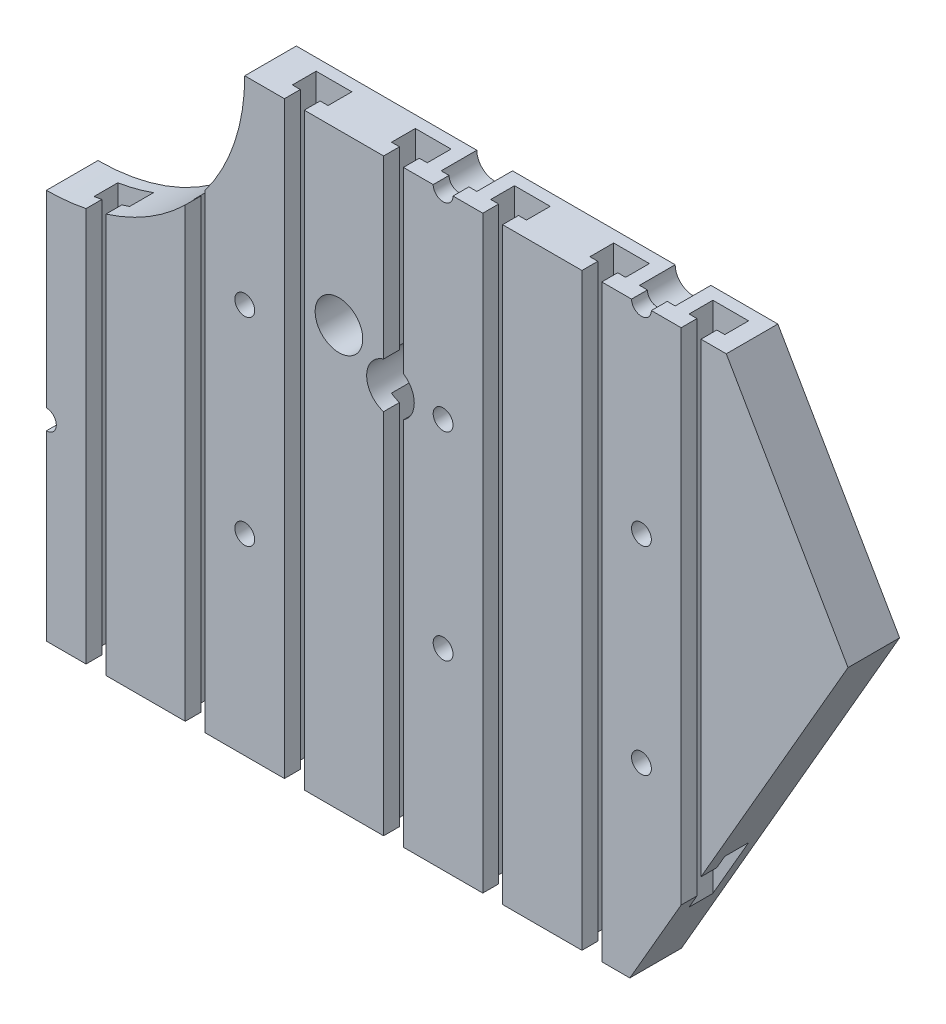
SolidWorks part; units mm, degrees
ref_plane "Plan de face" through (0, 0, 0) normal (0, 0, 1) x (1, 0, 0)
ref_plane "Plan de dessus" through (0, 0, 0) normal (0, 1, 0) x (1, 0, 0)
ref_plane "Plan de droite" through (0, 0, 0) normal (1, 0, 0) x (0, 0, -1)
sketch "Esquisse1" plane through (0, 0, 0) normal (0, 0, 1) x (1, 0, 0)
  line L6 (35.7636, 358.7862) -> (-423.8647, -437.3133) construction
  line L7 (-755.4678, -148.4209) -> (879.7592, -148.4209) construction
  line L8 (-46.1325, 376.7457) -> (415.4529, -422.7436) construction
  line L9 (257.0726, -148.4209) -> (-245.0999, 141.5085) construction
  line L10 (-257.0726, -148.4209) -> (263.2247, 151.9729) construction
  line L11 (-55, 201.5791) -> (55, 201.5791)
  line L12 (-147.0726, -148.4209) -> (147.0726, -148.4209)
  line L13 (147.0726, -148.4209) -> (202.0726, -53.1581)
  line L14 (202.0726, -53.1581) -> (55, 201.5791)
  line L15 (-147.0726, -148.4209) -> (-202.0726, -53.1581)
  line L16 (-202.0726, -53.1581) -> (-55, 201.5791)
  dimension "D1" = 60
  dimension "D2" = 60
  dimension "D3" = 110
  dimension "D4" = 350
  dimension "D5" = 60
  dimension "D6" = 60
  dimension "D7" = 110
  dimension "D8" = 110
extrude "Boss.-Extru.2" add sketch "Esquisse1" along normal blind 13
sketch "Esquisse3" plane through (0, 201.5791, 0) normal (0, 1, 0) x (1, 0, 0)
  line L0 (-12.5, 6.793) -> (-12.5, -19.2478) construction
  line L1 (-8, -3) -> (-17, -3)
  line L2 (-17, -3) -> (-17, -9)
  line L3 (-17, -9) -> (-15, -9)
  line L4 (-15, -9) -> (-15, -13)
  line L5 (55, -13) -> (-55, -13) construction
  line L6 (-10, -9) -> (-10, -13)
  line L7 (-8, -9) -> (-10, -9)
  line L8 (-8, -3) -> (-8, -9)
  line L9 (-15, -13) -> (-10, -13)
  point P2 (-12.5, -13)
  point P14 (-12.5, -3)
  dimension "D1" = 12.5
  dimension "D2" = 9
  dimension "D3" = 5
  dimension "D4" = 6
  dimension "D5" = 4
extrude "Enlèv. mat.-Extru.1" cut sketch "Esquisse3" against normal up to next
pattern_linear "Répétition linéaire1" count 8 spacing 25 along (1, 0, 0) of "Enlèv. mat.-Extru.1"
pattern_linear "Répétition linéaire2" count 7 spacing 25 along (-1, 0, 0) of "Enlèv. mat.-Extru.1"
sketch "3parties" plane through (0, 0, 0) normal (0, 0, 1) x (1, 0, 0)
  line L2 (-50, 0) -> (-171.3817, 0)
  line L3 (-165, 11.0535) -> (-202.0726, -53.1581) construction
  line L4 (50, 0) -> (171.3817, 0)
  line L5 (202.0726, -53.1581) -> (165, 11.0535) construction
  line L6 (0, -50) -> (0, -148.4209)
  line L7 (-10, -148.4209) -> (10, -148.4209) construction
  circle A0 centre (0, 0) radius 50
  dimension "D1" = 100
sketch "certcleRotules" plane through (0, 0, 13) normal (0, 0, 1) x (1, 0, 0)
  circle A0 centre (0, 0) radius 157.5
  dimension "D1" = 315
sketch "Esquisse6" plane through (0, 0, 0) normal (0, 1, 0) x (1, 0, 0)
  line L0 (-157.5, -13) -> (157.5, -13) construction
  line L1 (0, 0) -> (-4.5, 0)
  line L2 (0, 0) -> (0, -13)
  line L3 (-2.5, -9) -> (-4.5, -9)
  line L4 (-4.5, 0) -> (-4.5, -9)
  line L7 (0, -13) -> (-2.5, -13)
  line L8 (-2.5, -9) -> (-2.5, -13)
  dimension "D1" = 4.5
  dimension "D2" = 2.5
  dimension "D3" = 4
revolve "Enlèvement de matière-Révolution1" cut sketch "Esquisse6" angle 360 about L2
pattern_linear "Répétition linéaire3" count 4 spacing 50 along (0, 1, 0) count 4 spacing 50 along (1, 0, 0) of "Enlèvement de matière-Révolution1"
pattern_linear "Répétition linéaire5" count 3 spacing 50 along (0, -1, 0) count 4 spacing 50 along (1, 0, 0) of "Enlèvement de matière-Révolution1"
pattern_linear "Répétition linéaire6" count 4 spacing 50 along (0, 1, 0) count 4 spacing 50 along (-1, 0, 0) of "Enlèvement de matière-Révolution1"
pattern_linear "Répétition linéaire7" count 3 spacing 50 along (0, -1, 0) count 4 spacing 50 along (-1, 0, 0) of "Enlèvement de matière-Révolution1"
sketch "Esquisse8" plane through (0, 0, 0) normal (0, 0, -1) x (-1, 0, 0)
  circle A0 centre (0, 100) radius 4.5 construction
  circle A1 centre (0, 100) radius 4.5
extrude "bouchonBarreauHaut" add sketch "Esquisse8" against normal blind 13
sketch "Esquisse7" plane through (0, 0, 0) normal (0, 0, -1) x (-1, 0, 0)
  line L1 (-6.5, 105.15) -> (6.5, 105.15)
  line L2 (-6.5, 105.15) -> (-6.5, 80.15)
  line L3 (-6.5, 80.15) -> (6.5, 80.15)
  line L4 (6.5, 105.15) -> (6.5, 80.15)
  line L5 (0, 7.15) -> (0, -7.15) construction
  dimension "D1" = 25
  dimension "D2" = 80.15
  dimension "D3" = 13
  dimension "D4" = 6.5
extrude "Boss.-Extru.4" add sketch "Esquisse7" along normal blind 5
sketch "Esquisse9" plane through (0, 0, 0) normal (1, 0, 0) x (0, 0, -1)
  line L0 (5, 80.15) -> (0, 80.15) construction
  line L1 (5, 80.15) -> (5, 105.15) construction
  line L3 (5, 85.15) -> (5, 82.5)
  line L4 (5, 82.5) -> (-3, 82.5)
  line L6 (-3, -148.4209) -> (-3, 201.5791) construction
  line L7 (-13, 157.5) -> (-13, -157.5) construction
  line L8 (-3, 79.15) -> (-13, 79.15)
  line L9 (-3, 79.15) -> (-3, 82.5)
  line L10 (5, 85.15) -> (-13, 85.15)
  line L11 (-13, 79.15) -> (-13, 85.15)
  dimension "D1" = 5
  dimension "D2" = 2.65
  dimension "D3" = 6
revolve "Enlèvement de matière-Révolution2" cut sketch "Esquisse9" angle 360 about L10
pattern_linear "Répétition linéaire8" count 2 spacing 15 along (0, 1, 0) of "Enlèvement de matière-Révolution2"
pattern_circular "Répétition circulaire1" count 3 every 120 about axis through (0, 0, 0) along (0, 0, 1) of "Boss.-Extru.4", "Enlèvement de matière-Révolution2", "Répétition linéaire8"
sketch "Esquisse10" plane through (0, 0, 0) normal (1, 0, 0) x (0, 0, -1)
  line L0 (0, 201.5791) -> (0, -53.1581) construction
  line L1 (0, 77.5) -> (5, 77.5)
  line L2 (0, 77.5) -> (0, 72.5)
  line L3 (0, 72.5) -> (5, 72.5)
  line L4 (5, 77.5) -> (5, 72.5)
  line L5 (0, 50) -> (0, -50) construction
  line L6 (0, -72.5) -> (5, -72.5)
  line L7 (0, -72.5) -> (0, -77.5)
  line L8 (0, -77.5) -> (5, -77.5)
  line L9 (5, -72.5) -> (5, -77.5)
  line L10 (5, 80.15) -> (5, 105.15) construction
  line L11 (-9, 50) -> (0, 50) construction
  line L13 (-9, -100) -> (0, -100) construction
  point P16 (2.5, 72.5)
  point P19 (2.5, -72.5)
  dimension "D1" = 22.5
  dimension "D2" = 5
  dimension "D3" = 22.5
  dimension "D4" = 5
extrude "Boss.-Extru.6" add sketch "Esquisse10" along normal mid plane 215
chamfer "Chanfrein1" distance 5 angle 60 4 edges at (107.5, -75, -5) (-107.5, -75, -5) (-107.5, 75, -5) (107.5, 75, -5)
sketch "Esquisse11" plane through (0, 0, 13) normal (0, 0, 1) x (1, 0, 0)
  line L0 (-10, -148.4209) -> (-10, 201.5791) construction
  line L1 (-10, 23.5) -> (10, 23.5)
  line L2 (-10, 23.5) -> (-10, -23.5)
  line L3 (-10, -23.5) -> (10, -23.5)
  line L4 (10, 23.5) -> (10, -23.5)
  line L5 (10, -148.4209) -> (10, 201.5791) construction
  dimension "D1" = 47
  dimension "D2" = 23.5
extrude "Enlèv. mat.-Extru.2" cut sketch "Esquisse11" against normal blind 8.9
sketch "Esquisse13" plane through (-8, 0, 0) normal (-1, 0, 0) x (0, 0, 1)
  line L1 (4.1, -23.5) -> (11.1, -23.5)
  line L2 (4.1, -23.5) -> (4.1, -40)
  line L3 (4.1, -40) -> (6.1, -40)
  line L4 (11.1, -23.5) -> (11.1, -35)
  arc A0 (6.1, -40) -> (11.1, -35) centre (6.1, -35) ccw
  dimension "D2" = 5
  dimension "D1" = 16.5
  dimension "D3" = 7
extrude "Enlèv. mat.-Extru.3" cut sketch "Esquisse13" against normal up to surface (16 mm away)
sketch "Esquisse14" plane through (0, 0, 4.1) normal (0, 0, 1) x (1, 0, 0)
  line L0 (-8, 23.5) -> (-8, -40) construction
  line L1 (-3, -20) -> (3, -20)
  line L2 (-8, -25) -> (-8, -35)
  line L3 (-3, -40) -> (3, -40)
  line L4 (8, -25) -> (8, -35)
  line L5 (8, -40) -> (8, 23.5) construction
  line L6 (8, -40) -> (-8, -40) construction
  arc A0 (-8, -35) -> (-3, -40) centre (-3, -35) ccw
  arc A1 (3, -40) -> (8, -35) centre (3, -35) ccw
  arc A2 (3, -20) -> (8, -25) centre (3, -25) cw
  arc A3 (-3, -20) -> (-8, -25) centre (-3, -25) ccw
  point P16 (8, -20)
  point P19 (-8, -20)
  dimension "D3" = 5
  dimension "D1" = 20
extrude "Enlèv. mat.-Extru.4" cut sketch "Esquisse14" against normal up to next
mirror "Symétrie1" about plane through (0, 0, 0) normal (0, 1, 0) of "Enlèv. mat.-Extru.4", "Enlèv. mat.-Extru.3"
sketch "Esquisse15" plane through (0, 0, 0) normal (0, 0, -1) x (-1, 0, 0)
  circle A0 centre (-50, 0) radius 4.5 construction
  circle A1 centre (0, -50) radius 4.5 construction
  circle A2 centre (50, 0) radius 4.5 construction
  circle A3 centre (0, 50) radius 4.5 construction
  circle A4 centre (-50, 0) radius 4.5
  circle A5 centre (0, -50) radius 4.5
  circle A6 centre (50, 0) radius 4.5
  circle A7 centre (0, 50) radius 4.5
extrude "boucheTrousCEntre" add sketch "Esquisse15" against normal up to surface (13 mm away)
sketch "Esquisse17" plane through (0, 0, -5) normal (0, 0, -1) x (-1, 0, 0)
  line L5 (-171.3817, 0) -> (-50, 0)
  line L8 (147.0726, -148.4209) -> (202.0726, -53.1581) construction
  line L9 (147.0726, -148.4209) -> (202.0726, -53.1581)
  line L12 (0, -148.4209) -> (0, -50)
  line L13 (-171.3817, 0) -> (-55, 201.5791)
  line L14 (-55, 201.5791) -> (55, 201.5791)
  line L15 (55, 201.5791) -> (202.0726, -53.1581)
  line L16 (147.0726, -148.4209) -> (0, -148.4209)
  circle A0 centre (0, 0) radius 50 construction
  arc A1 (-50, 0) -> (0, -50) centre (0, 0) ccw
extrude "Enlèv. mat.-Extru.8" cut sketch "Esquisse17" against normal through all
